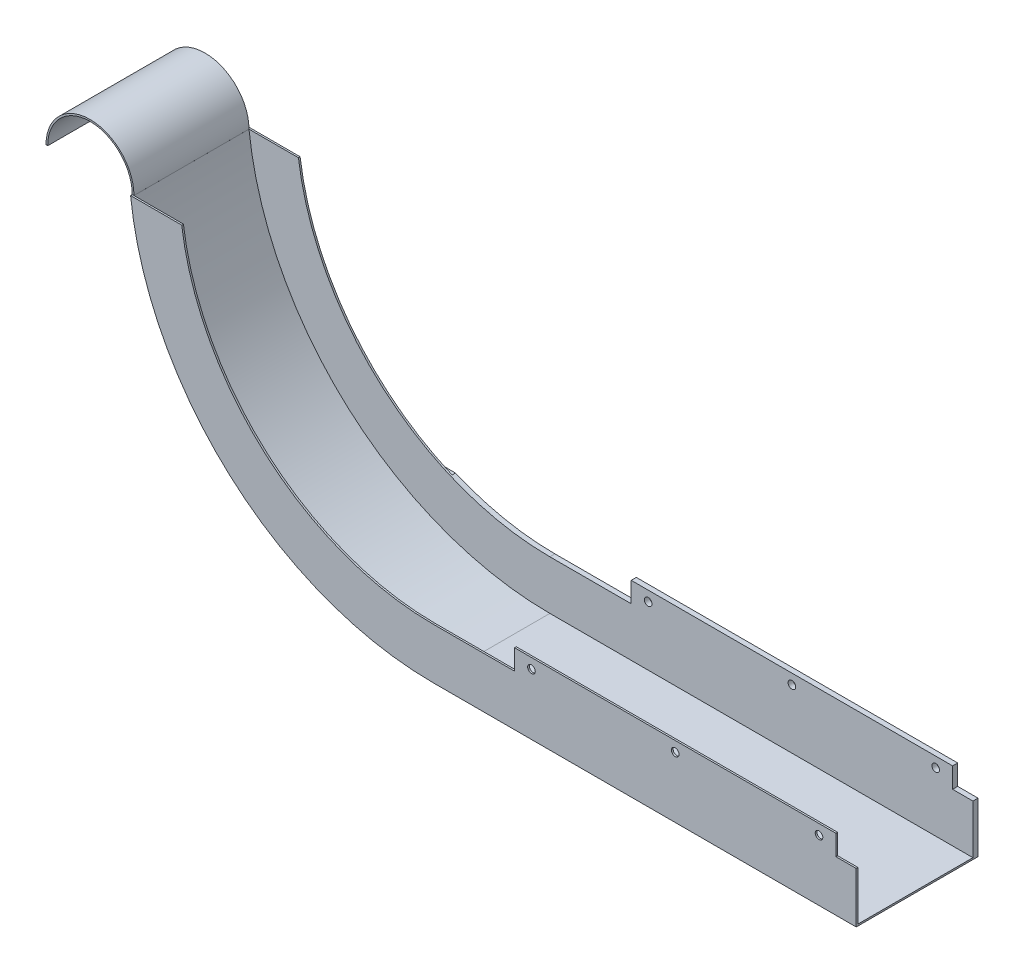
SolidWorks part; units mm, degrees
ref_plane "前视基准面" through (0, 0, 0) normal (0, 0, 1) x (1, 0, 0)
ref_plane "上视基准面" through (0, 0, 0) normal (0, 1, 0) x (1, 0, 0)
ref_plane "右视基准面" through (0, 0, 0) normal (1, 0, 0) x (0, 0, -1)
sketch "草图1" plane through (0, 0, 0) normal (0, 0, 1) x (1, 0, 0)
  line L0 (468, 42) -> (468, 54)
  line L1 (278, 42) -> (278, 54)
  line L2 (278, 0) -> (278, 12)
  line L3 (468, 0) -> (468, 12)
  line L4 (278, 0) -> (468, 0)
  line L5 (278, 54) -> (468, 54)
  line L6 (0, 172) -> (1, 172)
  line L7 (52, 172) -> (81.2248, 172)
  line L8 (480, 12) -> (480, 42)
  line L9 (229.8854, 42) -> (278, 42)
  line L10 (229.8854, 12) -> (278, 12)
  line L11 (468, 42) -> (480, 42)
  line L12 (468, 12) -> (480, 12)
  circle A0 centre (288, 6) radius 2.25
  circle A1 centre (373, 6) radius 2.25
  circle A2 centre (458, 6) radius 2.25
  circle A3 centre (458, 48) radius 2.25
  circle A4 centre (373, 48) radius 2.25
  circle A5 centre (288, 48) radius 2.25
  arc A6 (52, 172) -> (0, 172) centre (26, 172) ccw
  arc A7 (51, 172) -> (1, 172) centre (26, 172) ccw
  arc A8 (51, 172) -> (229.8854, 12) centre (229.8854, 192) ccw
  arc A9 (81.2248, 172) -> (229.8854, 42) centre (229.8854, 192) ccw
extrude "凸台-拉伸1" add sketch "草图1" along normal blind 72
sketch "草图3" plane through (480, 0, 0) normal (1, 0, 0) x (0, 0, -1)
  line L0 (-2, 0) -> (-2, 12)
  line L1 (-72, 12) -> (-72, 172)
  line L2 (-72, 12) -> (-2, 12)
  line L3 (-71, 198) -> (-3, 198)
  line L4 (-71, 172) -> (-71, 198)
  line L5 (-3, 172) -> (-3, 198)
  line L6 (-72, 172) -> (-71, 172)
  line L7 (-3, 172) -> (-2, 172)
  line L8 (0, 54) -> (-2, 54)
  line L9 (0, 0) -> (0, 54)
  line L10 (-2, 54) -> (-2, 172)
extrude "切除-拉伸2" cut sketch "草图3" against normal through all and the other way through all flip side to cut
sketch "草图4" plane through (480, 0, 0) normal (1, 0, 0) x (0, 0, -1)
  line L0 (-72, 12) -> (-72, 42) construction
  line L1 (-71, 64.6957) -> (-3, 64.6957)
  line L2 (-71, 64.6957) -> (-71, 13)
  line L3 (-71, 13) -> (-3, 13)
  line L4 (-3, 64.6957) -> (-3, 13)
  line L5 (-72, 12) -> (0, 12) construction
  line L6 (0, 12) -> (0, 42) construction
  dimension "D1" = 1
  dimension "D2" = 1
  dimension "D3" = 3
sketch "草图5" plane through (0, 0, 72) normal (0, 0, 1) x (1, 0, 0)
  line L0 (480, 12) -> (229.8854, 12)
  arc A0 (229.8854, 12) -> (51, 172) centre (229.8854, 192) cw
sweep "切除-扫描1" cut profiles "草图4" path "草图5"
